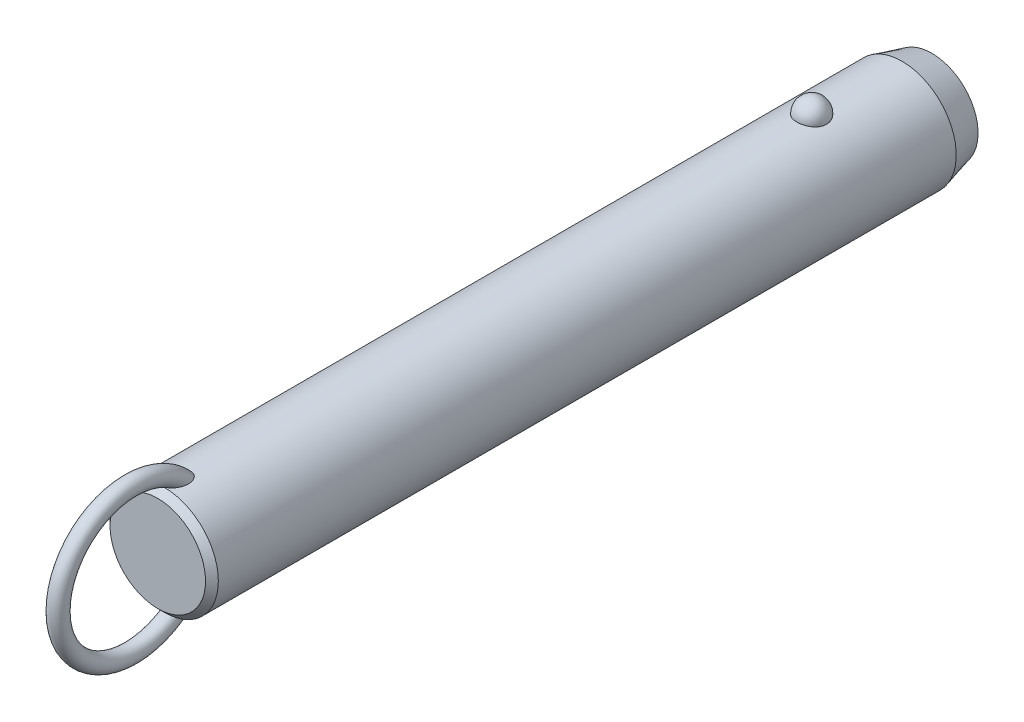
SolidWorks part; units mm, degrees
ref_plane "Front Plane" through (0, 0, 0) normal (0, 0, 1) x (1, 0, 0)
ref_plane "Top Plane" through (0, 0, 0) normal (0, 1, 0) x (1, 0, 0)
ref_plane "Right Plane" through (0, 0, 0) normal (1, 0, 0) x (0, 0, -1)
sketch "Sketch2" plane through (0, 0, 0) normal (0, 0, 1) x (1, 0, 0)
  circle A0 centre (0, 0) radius 12.7
  point P3 (0, 12.7)
  dimension "D1" = 25.4
extrude "Boss-Extrude1" add sketch "Sketch2" along normal blind 137.2
sketch "Sketch3" plane through (0, 0, 0) normal (0, 0, -1) x (-1, 0, 0)
  circle A0 centre (0, 0) radius 12.7
  dimension "D1" = 25.4
extrude "Boss-Extrude2" add sketch "Sketch3" along normal blind 31.7
chamfer "Chamfer1" distance 7 angle 15 1 edges at (-12.7, 0, -31.7)
sketch "Sketch12" plane through (0, 0, 0) normal (1, 0, 0) x (0, 0, -1)
  line L0 (-137.2, 12.7) -> (-137.2, -12.7) construction
  point P0 (-137.2, 0)
sketch "Sketch13" plane through (0, 0, 0) normal (1, 0, 0) x (0, 0, -1)
  circle A0 centre (-156.25, 0) radius 19.05
  point P2 (-137.2, 0)
  dimension "D1" = 38.1
sketch "Sketch14" plane through (0, 0, 0) normal (0, 1, 0) x (1, 0, 0)
  circle A0 centre (0, -139.2) radius 2
  point P2 (0, -137.2)
  dimension "D1" = 4
sweep "Sweep1" add profiles "Sketch14" path "Sketch13"
sketch "Sketch15" plane through (0, 0, 137.2) normal (0, 0, 1) x (1, 0, 0)
  circle A0 centre (0, 0) radius 12.7
  dimension "D1" = 25.4
extrude "Boss-Extrude3" add sketch "Sketch15" along normal blind 12.7
chamfer "Chamfer2" distance 1.5 angle 45 1 edges at (12.7, 0, 149.9)
sketch "Sketch18" plane through (0, 0, 0) normal (1, 0, 0) x (0, 0, -1)
  line L0 (24.7, 12.7) -> (-142.051, 12.7) construction
  line L1 (3.5, 16.2) -> (3.5, 9.2)
  line L2 (-142.051, -12.7) -> (24.7, -12.7) construction
  arc A0 (3.5, 16.2) -> (3.5, 9.2) centre (3.5, 12.7) ccw
  point P4 (0, 12.7)
  dimension "D1" = 28.9
revolve "Revolve1" add sketch "Sketch18" angle 360 about L1
